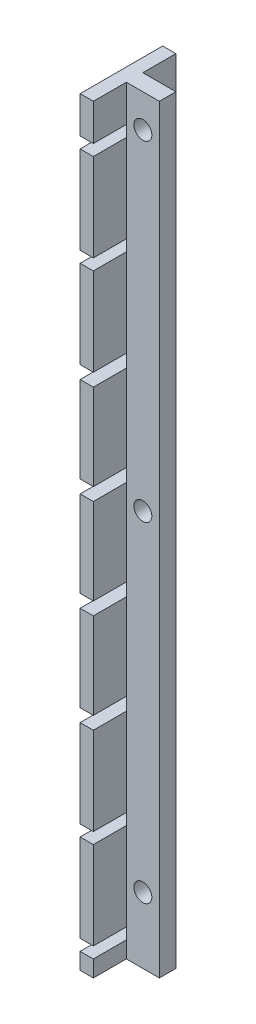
SolidWorks part; units mm, degrees
ref_plane "Front" through (0, 0, 0) normal (0, 0, 1) x (1, 0, 0)
ref_plane "Top" through (0, 0, 0) normal (0, 1, 0) x (1, 0, 0)
ref_plane "Right" through (0, 0, 0) normal (1, 0, 0) x (0, 0, -1)
sketch "Sketch1" plane through (0, 0, 0) normal (0, 0, 1) x (1, 0, 0)
  line L0 (-6.35, -520.7) -> (-6.35, 0) construction
  line L1 (-6.35, -374.65) -> (0, -374.65)
  line L2 (-6.35, -374.65) -> (-6.35, -520.7)
  line L3 (-6.35, -520.7) -> (0, -520.7)
  line L4 (0, -374.65) -> (0, -520.7)
  dimension "D1" = 146.05
extrude "Base-Extrude" add sketch "Sketch1" along normal blind 3.175
sketch "Sketch2" plane through (0, 0, 3.175) normal (0, 0, 1) x (1, 0, 0)
  circle A0 centre (-3.175, -508) radius 1.7272
  circle A1 centre (-3.175, -444.5) radius 1.7272
  circle A2 centre (-3.175, -381) radius 1.7272
  dimension "D1" = 3.4544
  dimension "D2" = 3.4544
  dimension "D3" = 3.4544
  dimension "D4" = 63.5
  dimension "D5" = 63.5
extrude "Cut-Extrude1" cut sketch "Sketch2" against normal blind 3.175
sketch "Sketch3" plane through (0, -374.65, 0) normal (0, 1, 0) x (-1, 0, 0)
  line L0 (0, 3.175) -> (6.35, 3.175) construction
  line L1 (6.35, 9.525) -> (8.89, 9.525)
  line L2 (6.35, 9.525) -> (6.35, -6.35)
  line L3 (6.35, -6.35) -> (8.89, -6.35)
  line L4 (8.89, 9.525) -> (8.89, -6.35)
  line L5 (6.35, 0) -> (0, 0) construction
  line L6 (7.3025, -76.708) -> (7.3025, 25.527) construction
  dimension "D1" = 6.35
  dimension "D2" = 6.35
  dimension "D3" = 2.54
  dimension "D4" = 1.5875
extrude "Boss-Extrude3" add sketch "Sketch3" against normal blind 146.05
sketch "Sketch4" plane through (0, 0, 9.525) normal (0, 0, 1) x (1, 0, 0)
  line L0 (-8.89, -520.7) -> (-8.89, -374.65) construction
  line L1 (-8.89, -515.366) -> (-6.35, -515.366)
  line L2 (-8.89, -515.366) -> (-8.89, -517.525)
  line L3 (-8.89, -517.525) -> (-6.35, -517.525)
  line L4 (-6.35, -515.366) -> (-6.35, -517.525)
  line L5 (0, -520.7) -> (-7.9375, -520.7) construction
  line L6 (-7.3025, -477.139) -> (-45.4025, -477.139) construction
  line L7 (-8.89, -476.9485) -> (-6.35, -476.9485)
  line L8 (-8.89, -476.9485) -> (-8.89, -479.1075)
  line L9 (-8.89, -479.1075) -> (-6.35, -479.1075)
  line L10 (-6.35, -476.9485) -> (-6.35, -479.1075)
  line L11 (-7.3025, -478.917) -> (-45.4025, -478.917) construction
  dimension "D1" = 2.159
  dimension "D2" = 3.175
  dimension "D3" = 2.54
  dimension "D4" = 2.159
  dimension "D5" = 2.54
  dimension "D6" = 0.1905
  dimension "D7" = 0.1905
extrude "Cut-Extrude2" cut sketch "Sketch4" against normal blind 19.05
pattern_linear "LPattern1" count 6 spacing 19.05 along (0, 1, 0) of "Cut-Extrude2"
